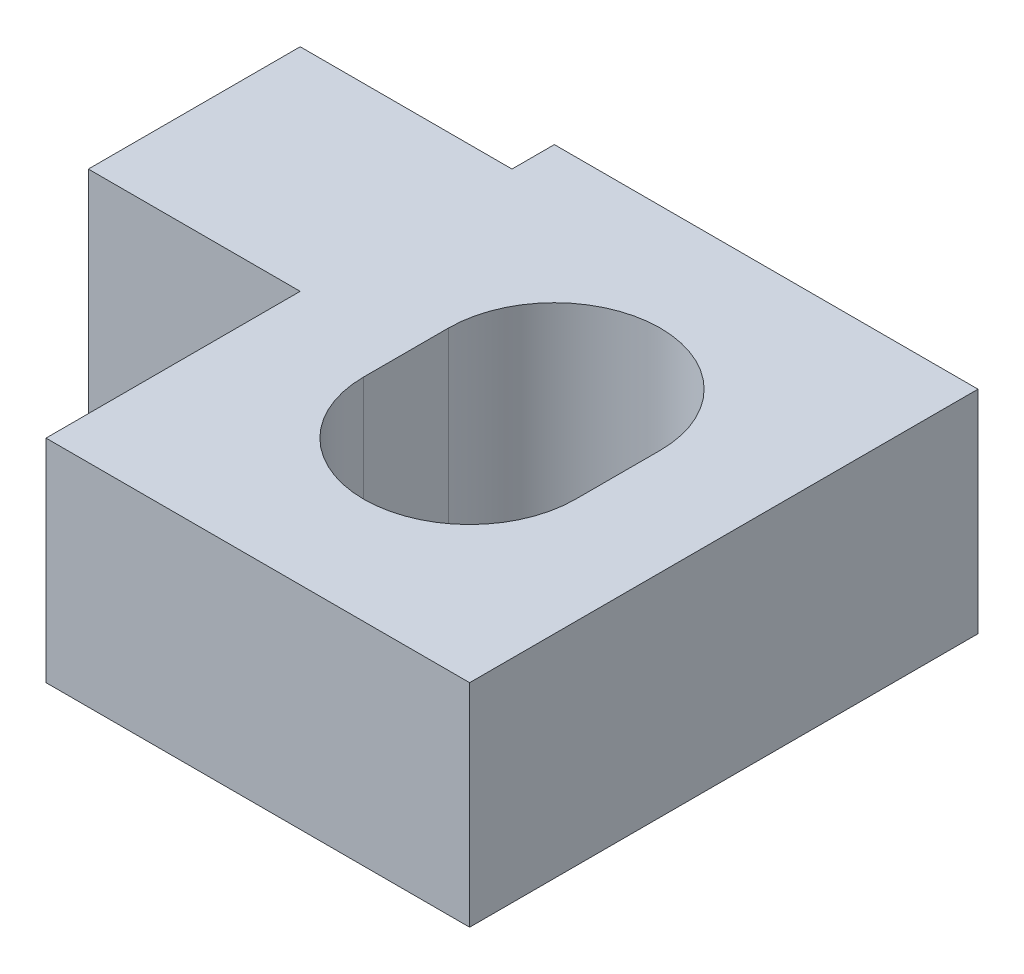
SolidWorks part; units mm, degrees
ref_plane "Front Plane" through (0, 0, 0) normal (0, 0, 1) x (1, 0, 0)
ref_plane "Top Plane" through (0, 0, 0) normal (0, 1, 0) x (1, 0, 0)
ref_plane "Right Plane" through (0, 0, 0) normal (1, 0, 0) x (0, 0, -1)
sketch "Sketch1" plane through (0, 0, 0) normal (0, 1, 0) x (1, 0, 0)
  line L0 (5, 6) -> (5, -6)
  line L3 (-5, -6) -> (5, -6)
  line L11 (0, -1) -> (0, 1) construction
  line L12 (-2.5, -1) -> (-2.5, 1)
  line L13 (2.5, -1) -> (2.5, 1)
  line L14 (-10, 0) -> (-5, 0)
  line L15 (-5, 0) -> (-5, -6)
  line L16 (-10, 0) -> (-10, 5)
  line L17 (-10, 5) -> (-5, 5)
  line L19 (-5, 5) -> (-5, 6)
  line L20 (-5, 6) -> (5, 6)
  arc A0 (-2.5, -1) -> (2.5, -1) centre (0, -1) ccw
  arc A1 (2.5, 1) -> (-2.5, 1) centre (0, 1) ccw
  point P0 (0, 0)
  point P11 (0, 0)
  dimension "D1" = 5
  dimension "D2" = 12
  dimension "D3" = 5
  dimension "D4" = 5
  dimension "D5" = 5
  dimension "D6" = 1
  dimension "D7" = 5
  dimension "D8" = 5
  dimension "D9" = 5
extrude "Boss-Extrude1" add sketch "Sketch1" along normal blind 5
